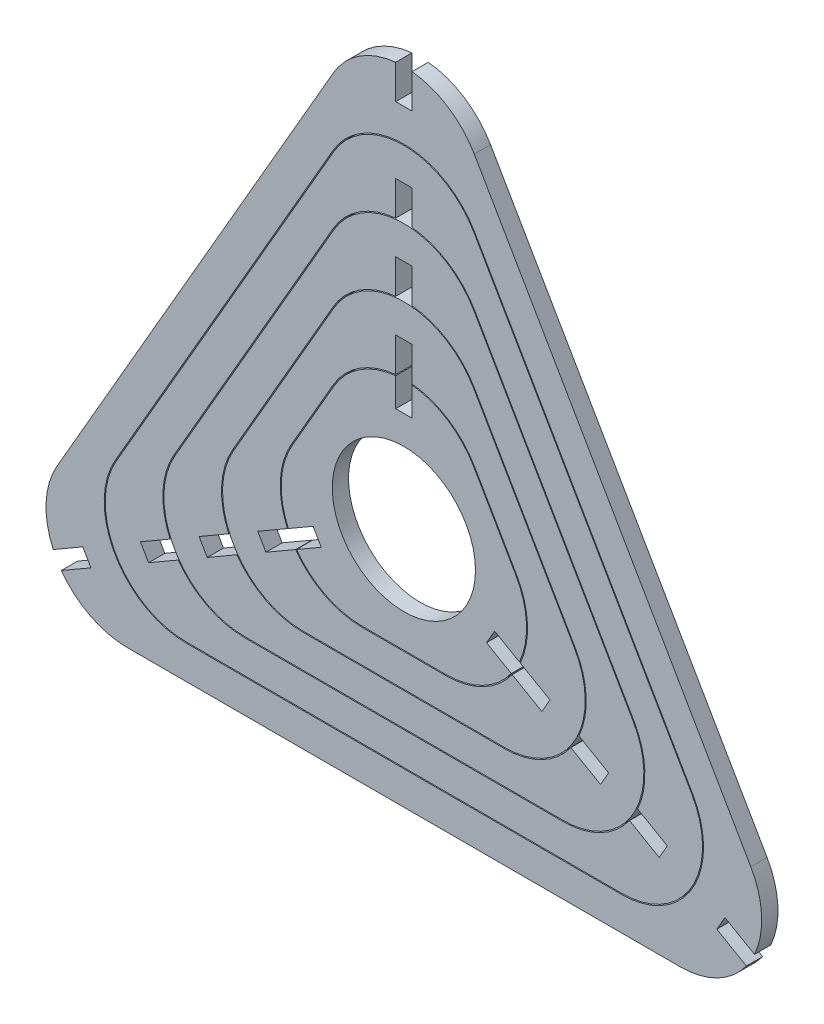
SolidWorks part; units mm, degrees
ref_plane "Спереди" through (0, 0, 0) normal (0, 0, 1) x (1, 0, 0)
ref_plane "Сверху" through (0, 0, 0) normal (0, 1, 0) x (1, 0, 0)
ref_plane "Справа" through (0, 0, 0) normal (1, 0, 0) x (0, 0, -1)
sketch "Эскиз1" plane through (0, 0, 0) normal (0, 0, 1) x (1, 0, 0)
  line L0 (102.6795, -59.282) -> (0, 118.5641)
  line L1 (0, 138.5641) -> (-120, -69.282) construction
  line L2 (-120, -69.282) -> (120, -69.282) construction
  line L3 (120, -69.282) -> (0, 138.5641) construction
  line L4 (0, 118.5641) -> (-102.6795, -59.282)
  line L5 (-102.6795, -59.282) -> (102.6795, -59.282)
  line L6 (102.6795, -59.282) -> (0, 118.5641) construction
  line L7 (0, 118.5641) -> (-102.6795, -59.282) construction
  line L8 (-102.6795, -59.282) -> (102.6795, -59.282) construction
  circle A0 centre (0, 0) radius 69.282 construction
extrude "Бобышка-Вытянуть1" add sketch "Эскиз1" along normal blind 4 contours L4 L5 L0
sketch "Эскиз3" plane through (0, 0, 4) normal (0, 0, 1) x (1, 0, 0)
  line L0 (44.1229, 25.4743) -> (36.906, 21.3077) construction
  line L1 (36.906, 21.3077) -> (29.6891, 17.141) construction
  line L2 (29.6891, 17.141) -> (22.4722, 12.9743) construction
  line L3 (56.4915, -12.6154) -> (17.3205, 55.2307)
  line L4 (-17.3205, 55.2307) -> (-56.4915, -12.6154)
  line L5 (-39.171, -42.6154) -> (39.171, -42.6154)
  line L6 (88.2457, -50.9487) -> (0, 101.8974)
  line L7 (0, 101.8974) -> (-88.2457, -50.9487)
  line L8 (-88.2457, -50.9487) -> (88.2457, -50.9487)
  line L9 (70.9252, -20.9487) -> (17.3205, 71.8974)
  line L10 (-17.3205, 71.8974) -> (-70.9252, -20.9487)
  line L11 (-53.6047, -50.9487) -> (53.6047, -50.9487)
  line L12 (42.0577, -4.282) -> (17.3205, 38.5641)
  line L13 (-17.3205, 38.5641) -> (-42.0577, -4.282)
  line L14 (-24.7372, -34.282) -> (24.7372, -34.282)
  line L15 (27.624, 4.0513) -> (17.3205, 21.8974)
  line L16 (-17.3205, 21.8974) -> (-27.624, 4.0513)
  line L17 (-10.3034, -25.9487) -> (10.3034, -25.9487)
  line L18 (44.1229, 25.4743) -> (51.3397, 29.641) construction
  line L19 (102.6795, -59.282) -> (0, 118.5641) construction
  line L20 (88.2457, -50.9487) -> (0, 101.8974) construction
  line L21 (0, 101.8974) -> (-88.2457, -50.9487) construction
  line L22 (73.812, -42.6154) -> (0, 85.2307) construction
  line L23 (0, 85.2307) -> (-73.812, -42.6154) construction
  line L24 (59.3782, -34.282) -> (0, 68.5641) construction
  line L25 (0, 68.5641) -> (-59.3782, -34.282) construction
  line L26 (44.9445, -25.9487) -> (0, 51.8974) construction
  line L27 (0, 51.8974) -> (-44.9445, -25.9487) construction
  line L28 (-44.9445, -25.9487) -> (44.9445, -25.9487) construction
  line L29 (-59.3782, -34.282) -> (59.3782, -34.282) construction
  line L30 (-73.812, -42.6154) -> (73.812, -42.6154) construction
  line L31 (-88.2457, -50.9487) -> (88.2457, -50.9487) construction
  line L32 (22.4722, 12.9743) -> (15.2554, 8.8077) construction
  arc A0 (17.3205, 71.8974) -> (-17.3205, 71.8974) centre (0, 61.8974) ccw
  arc A1 (17.3205, 55.2307) -> (-17.3205, 55.2307) centre (0, 45.2307) ccw
  arc A2 (17.3205, 38.5641) -> (-17.3205, 38.5641) centre (0, 28.5641) ccw
  arc A3 (17.3205, 21.8974) -> (-17.3205, 21.8974) centre (0, 11.8974) ccw
  arc A4 (-27.624, 4.0513) -> (-10.3034, -25.9487) centre (-10.3034, -5.9487) ccw
  arc A5 (-42.0577, -4.282) -> (-24.7372, -34.282) centre (-24.7372, -14.282) ccw
  arc A6 (-56.4915, -12.6154) -> (-39.171, -42.6154) centre (-39.171, -22.6154) ccw
  arc A7 (-70.9252, -20.9487) -> (-53.6047, -50.9487) centre (-53.6047, -30.9487) ccw
  arc A8 (70.9252, -20.9487) -> (53.6047, -50.9487) centre (53.6047, -30.9487) cw
  arc A9 (56.4915, -12.6154) -> (39.171, -42.6154) centre (39.171, -22.6154) cw
  arc A10 (42.0577, -4.282) -> (24.7372, -34.282) centre (24.7372, -14.282) cw
  arc A11 (27.624, 4.0513) -> (10.3034, -25.9487) centre (10.3034, -5.9487) cw
fillet "Скругление1" radius 20 3 edges at (0, 118.5641, 2) (-102.6795, -59.282, 2) (102.6795, -59.282, 2)
extrude "Вырез-Вытянуть-Тонкостенный3" cut sketch "Эскиз3" against normal through all both and the other way through all thin contours L15 A3 L16 A4 L17 A11 | L12 A2 L13 A5 L14 A10 | L3 A1 L4 A6 L5 A9 | L9 A0 L10 A7 L11 A8
sketch "Эскиз4" plane through (0, 0, 4) normal (0, 0, 1) x (1, 0, 0)
  circle A0 centre (0, 0) radius 17.6154
extrude "Вырез-Вытянуть1" cut sketch "Эскиз4" against normal blind 10
sketch "Эскиз6" plane through (0, 0, 0) normal (0, 1, 0) x (1, 0, 0)
  line L0 (0, 0) -> (0, -71.4396) construction
sketch "Эскиз5" plane through (0, 0, 4) normal (0, 0, 1) x (1, 0, 0)
  line L0 (0, 17.6154) -> (0, 31.8974) construction
  line L1 (1.875, 24.7564) -> (-1.875, 24.7564)
  line L2 (1.875, 24.7564) -> (1.875, 31.8093)
  line L4 (-1.875, 24.7564) -> (-1.875, 31.8093)
  line L5 (1.875, 24.7564) -> (-1.875, 31.8093) construction
  line L6 (1.875, 31.8093) -> (-1.875, 24.7564) construction
  line L7 (0, 81.8974) -> (0, 98.476) construction
  line L8 (-1.875, 90.1867) -> (1.875, 90.1867)
  line L9 (-1.875, 90.1867) -> (-1.875, 98.476)
  line L11 (1.875, 90.1867) -> (1.875, 98.476)
  line L12 (-1.875, 90.1867) -> (1.875, 98.476) construction
  line L13 (-1.875, 98.476) -> (1.875, 90.1867) construction
  line L14 (0, 81.8974) -> (0, 65.2307) construction
  line L15 (0, 65.2307) -> (0, 48.5641) construction
  line L16 (0, 48.5641) -> (0, 31.8974) construction
  line L18 (-1.875, 73.5641) -> (1.875, 73.5641)
  line L19 (-1.875, 73.5641) -> (-1.875, 65.1426)
  line L21 (1.875, 73.5641) -> (1.875, 65.1426)
  line L22 (-1.875, 73.5641) -> (1.875, 65.1426) construction
  line L23 (-1.875, 65.1426) -> (1.875, 73.5641) construction
  line L24 (-1.875, 56.8974) -> (1.875, 56.8974)
  line L25 (-1.875, 56.8974) -> (-1.875, 48.476)
  line L27 (1.875, 56.8974) -> (1.875, 48.476)
  line L28 (-1.875, 56.8974) -> (1.875, 48.476) construction
  line L29 (-1.875, 48.476) -> (1.875, 56.8974) construction
  line L30 (-1.875, 40.2307) -> (1.875, 40.2307)
  line L31 (-1.875, 40.2307) -> (-1.875, 31.8093)
  line L33 (1.875, 40.2307) -> (1.875, 31.8093)
  line L34 (-1.875, 40.2307) -> (1.875, 31.8093) construction
  line L35 (-1.875, 31.8093) -> (1.875, 40.2307) construction
  circle A0 centre (0, 0) radius 17.6154 construction
  arc A3 (17.3205, 71.8974) -> (-17.3205, 71.8974) centre (0, 61.8974) ccw construction
  arc A4 (17.3205, 88.5641) -> (-17.3205, 88.5641) centre (0, 78.5641) ccw construction
  arc A7 (17.3205, 55.2307) -> (-17.3205, 55.2307) centre (0, 45.2307) ccw construction
  arc A8 (17.3205, 38.5641) -> (-17.3205, 38.5641) centre (0, 28.5641) ccw construction
  arc A9 (17.3205, 21.8974) -> (-17.3205, 21.8974) centre (0, 11.8974) ccw construction
  point P0 (0, 28.2828)
  point P5 (0, 94.3313)
  point P8 (0, 52.6867)
  point P13 (-2, 31.7631)
  point P18 (0, 24.7564)
  point P19 (0, 24.7564)
  point P32 (0, 90.1867)
  point P33 (0, 90.1867)
  point P47 (0, 69.3534)
  point P53 (0, 36.02)
  point P58 (0, 0)
  point P59 (0, 99.5262)
  point P60 (0, 40.2307)
  point P61 (0, 40.2307)
  point P62 (0, 0)
  point P63 (1.7456, 65.1057)
  point P64 (-2, 33.0619)
  point P65 (0, 56.8974)
  point P66 (0, 56.8974)
  point P67 (0, 0)
  point P68 (0, 73.5641)
  point P69 (0, 73.5641)
extrude "Вырез-Вытянуть-Тонкостенный4" cut sketch "Эскиз5" against normal blind 10 thin
pattern_circular "Круговой массив1" count 3 over 360 about axis through (0, 0, 0) along (0, 0, 1) of "Вырез-Вытянуть-Тонкостенный4"
other "Сохранить тела1"
equation "\"thick\"= 4"
equation "\"tool\"= 0.25"
equation "\"triangle\"= 240"
equation "\"D1@Эскиз1\"= \"triangle\""
equation "\"thick 2\"=10"
equation "\"D2@Эскиз1\"= \"thick 2\""
equation "\"R\"= 20"
equation "\"D1@Бобышка-Вытянуть1\"= \"thick\""
equation "\"thick 3\"= \"thick 2\" / 1.2"
equation "\"D1@Эскиз3\"= \"thick 3\""
equation "\"D2@Эскиз3\"= \"R\""
equation "\"D1@Скругление1\"= \"R\""
equation "\"D5@Вырез-Вытянуть-Тонкостенный3\"= \"tool\""
equation "\"thik- tool\"= \"thick\" - \"tool\""
equation "\"D1@Эскиз5\"= \"thik- tool\""
